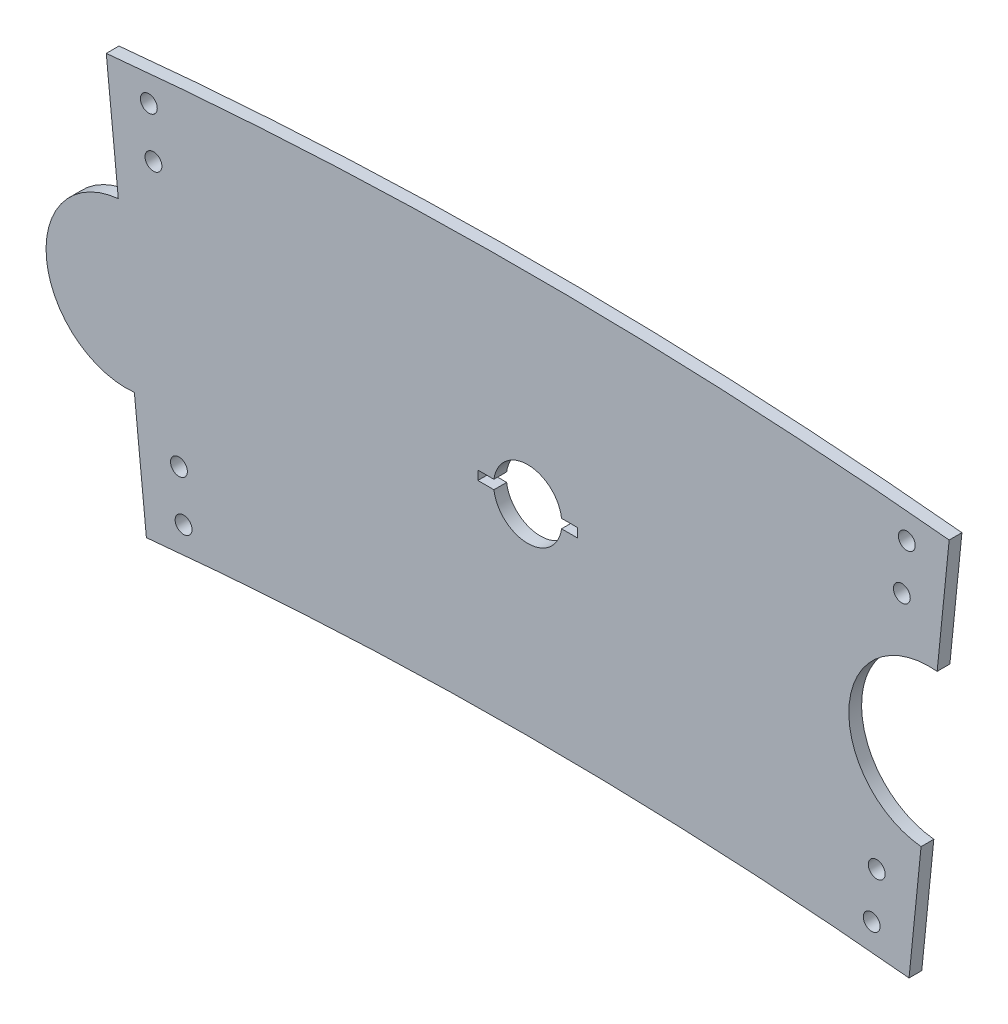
SolidWorks part; units mm, degrees
ref_plane "Front Plane" through (0, 0, 0) normal (0, 0, 1) x (1, 0, 0)
ref_plane "Top Plane" through (0, 0, 0) normal (0, 1, 0) x (1, 0, 0)
ref_plane "Right Plane" through (0, 0, 0) normal (1, 0, 0) x (0, 0, -1)
sketch "Sketch1" plane through (0, 0, 0) normal (0, 0, 1) x (1, 0, 0)
  line L0 (8.4252, 1.125) -> (12.4252, 1.125) construction
  line L1 (12.4252, 1.125) -> (12.4252, -1.125) construction
  line L2 (12.4252, -1.125) -> (8.4252, -1.125) construction
  line L3 (-8.4252, -1.125) -> (-12.4252, -1.125) construction
  line L4 (-12.4252, 1.125) -> (-8.4252, 1.125) construction
  line L5 (-12.4252, -1.125) -> (-12.4252, 1.125) construction
  line L6 (-12.4252, 1.125) -> (-8.4252, 1.125)
  line L7 (-12.4252, -1.125) -> (-12.4252, 1.125)
  line L8 (-8.4252, -1.125) -> (-12.4252, -1.125)
  line L9 (12.4252, -1.125) -> (8.4252, -1.125)
  line L10 (12.4252, 1.125) -> (12.4252, -1.125)
  line L11 (8.4252, 1.125) -> (12.4252, 1.125)
  line L12 (-105, 44.7368) -> (-102, 14.8872)
  line L13 (0, 0) -> (0, -1000) construction
  line L14 (0, 0) -> (192.465, 0) construction
  line L15 (105, 44.7368) -> (0, -1000) construction
  line L16 (0, -1000) -> (-105, 44.7368) construction
  line L21 (-95, -54.7619) -> (-98, -24.9123)
  line L22 (95, -54.7619) -> (98, -24.9123)
  line L23 (105, 44.7368) -> (102, 14.8872)
  arc A0 (-8.4252, -1.125) -> (8.4252, -1.125) centre (0, 0) ccw construction
  circle A1 centre (0, 0) radius 100 construction
  arc A3 (8.4252, 1.125) -> (-8.4252, 1.125) centre (0, 0) ccw construction
  arc A4 (8.4252, 1.125) -> (-8.4252, 1.125) centre (0, 0) ccw
  arc A5 (-8.4252, -1.125) -> (8.4252, -1.125) centre (0, 0) ccw
  arc A6 (102, 14.8872) -> (98, -24.9123) centre (100, -5.0126) ccw
  circle A8 centre (0, -1000) radius 1000 construction
  arc A9 (95, -54.7619) -> (-95, -54.7619) centre (0, -1000) ccw
  arc A10 (105, 44.7368) -> (-105, 44.7368) centre (0, -1000) ccw
  arc A11 (-102, 14.8872) -> (-98, -24.9123) centre (-100, -5.0126) ccw
  point P8 (0, 50)
  point P9 (0, -50)
  point P10 (-100, -5.0126)
  point P20 (100, -5.0126)
  dimension "D1" = 200
  dimension "D2" = 2000
  dimension "D4" = 20
  dimension "D3" = 50
extrude "Boss-Extrude1" add sketch "Sketch1" along normal blind 3.175
sketch "Sketch3" plane through (0, 0, 3.175) normal (0, 0, 1) x (1, 0, 0)
  circle A1 centre (-94.3968, 39.2339) radius 2.1
  circle A2 centre (-93.2395, 27.2898) radius 2.1
  circle A3 centre (-86.8968, -35.3902) radius 2.1
  circle A4 centre (-85.7395, -47.3343) radius 2.1
  circle A5 centre (85.704, -47.259) radius 2.1
  circle A6 centre (86.9466, -35.3236) radius 2.1
  circle A7 centre (93.204, 27.365) radius 2.1
  circle A8 centre (94.4466, 39.3005) radius 2.1
  point P2 (-93.2395, 27.2898)
  point P3 (-94.3968, 39.2339)
  point P4 (-85.7395, -47.3343)
  point P5 (-86.8968, -35.3902)
  point P6 (93.204, 27.365)
  point P7 (94.4466, 39.3005)
  point P8 (86.9466, -35.3236)
  point P9 (85.704, -47.259)
extrude "Cut-Extrude1" cut sketch "Sketch3" against normal blind 10
